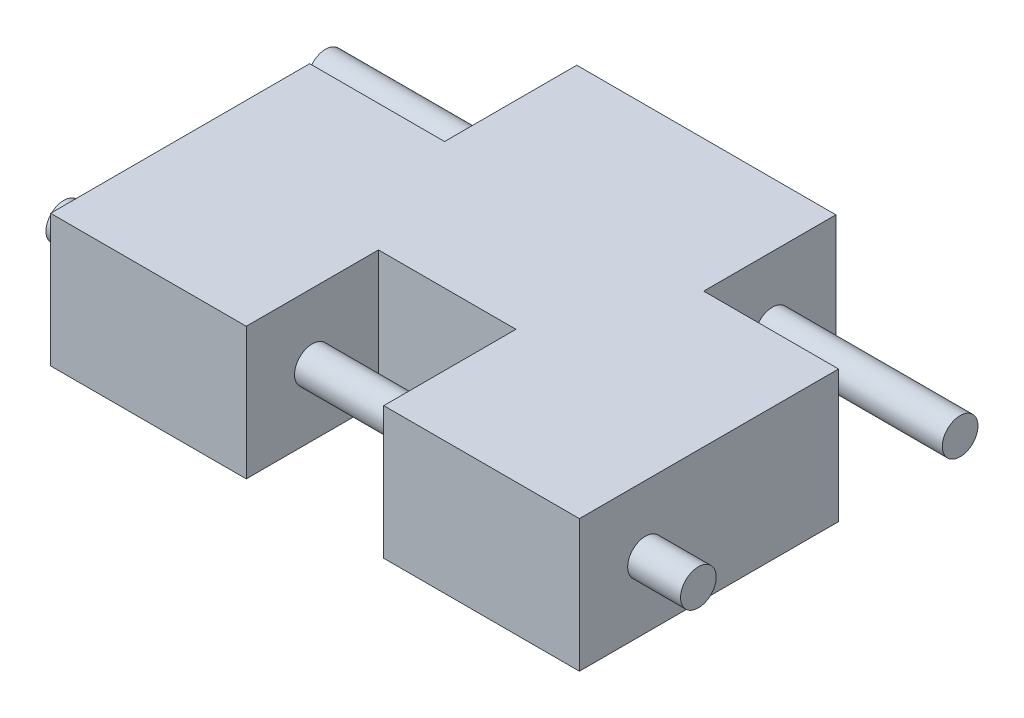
SolidWorks part; units mm, degrees
ref_plane "Front Plane" through (0, 0, 0) normal (0, 0, 1) x (1, 0, 0)
ref_plane "Top Plane" through (0, 0, 0) normal (0, 1, 0) x (1, 0, 0)
ref_plane "Right Plane" through (0, 0, 0) normal (1, 0, 0) x (0, 0, -1)
sketch "Sketch1" plane through (0, 0, 0) normal (0, 1, 0) x (1, 0, 0)
  line L0 (-6.223, 6.223) -> (6.223, 6.223)
  line L1 (6.223, 6.223) -> (6.223, -0.127)
  line L2 (6.223, -0.127) -> (12.7, -0.127)
  line L3 (12.7, -0.127) -> (12.7, -12.573)
  line L4 (12.7, -12.573) -> (3.302, -12.573)
  line L5 (3.302, -12.573) -> (3.302, -6.223)
  line L6 (3.302, -6.223) -> (-3.302, -6.223)
  line L7 (-3.302, -6.223) -> (-3.302, -12.573)
  line L8 (-3.302, -12.573) -> (-12.7, -12.573)
  line L9 (-12.7, -12.573) -> (-12.7, -0.127)
  line L10 (-12.7, -0.127) -> (-6.223, -0.127)
  line L11 (-6.223, -0.127) -> (-6.223, 6.223)
  dimension "D1" = 12.446
  dimension "D2" = 6.35
  dimension "D3" = 12.446
  dimension "D4" = 9.398
  dimension "D5" = 6.35
  dimension "D6" = 6.604
  dimension "D7" = 6.477
  dimension "D8" = 6.223
  dimension "D9" = 6.223
extrude "FingerBase" add sketch "Sketch1" along normal blind 6.35
sketch "Sketch2" plane through (12.7, 0, 0) normal (1, 0, 0) x (0, 0, -1)
  line L0 (-12.573, 6.35) -> (-0.127, 6.35) construction
  line L1 (-12.573, 6.35) -> (-12.573, 0) construction
  line L2 (-0.127, 6.35) -> (6.223, 6.35) construction
  line L3 (6.223, 6.35) -> (6.223, 0) construction
  circle A0 centre (-9.398, 3.175) radius 0.8572
  circle A1 centre (3.175, 3.175) radius 0.8573
  dimension "D1" = 1.7145
  dimension "D2" = 3.175
  dimension "D3" = 3.175
  dimension "D4" = 3.175
  dimension "D5" = 3.048
extrude "Boss-Extrude1" add sketch "Sketch2" along normal blind 2.54 and the other way blind 27.94
